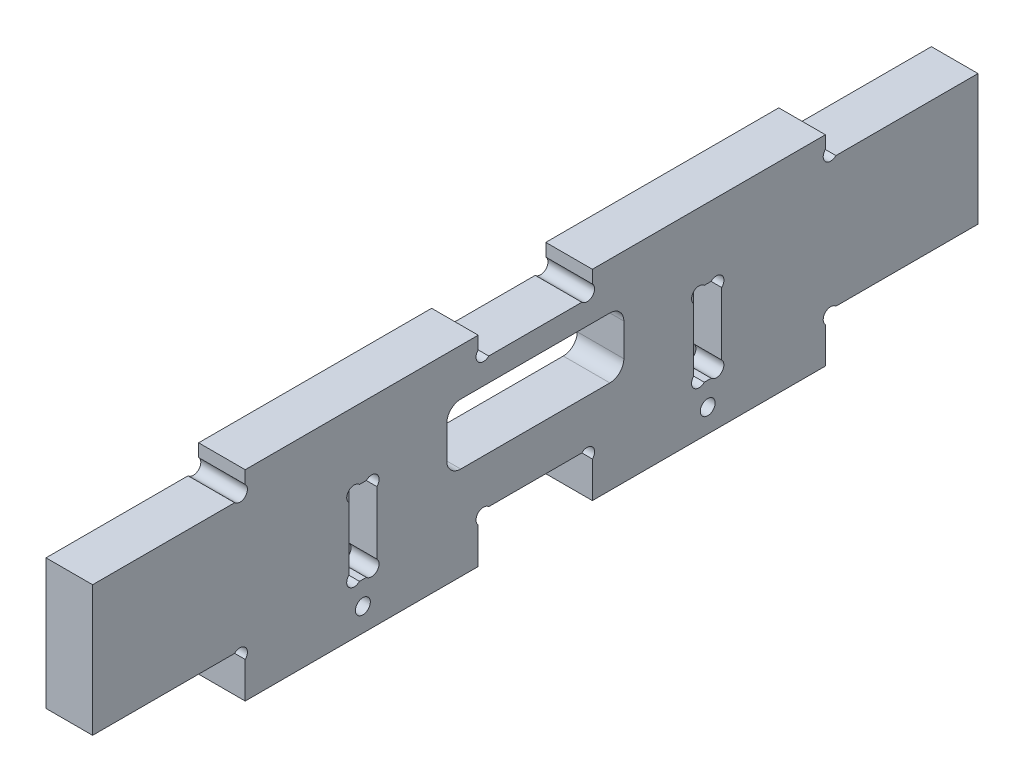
SolidWorks part; units mm, degrees
ref_plane "Plan de face" through (0, 0, 0) normal (0, 0, 1) x (1, 0, 0)
ref_plane "Plan de dessus" through (0, 0, 0) normal (0, 1, 0) x (1, 0, 0)
ref_plane "Plan de droite" through (0, 0, 0) normal (1, 0, 0) x (0, 0, -1)
sketch "Esquisse1" plane through (0, 0, 0) normal (1, 0, 0) x (0, 0, -1)
  line L0 (-8.7019, 0) -> (273.6235, 0) construction
  line L1 (0, -8.4667) -> (0, 81.5583) construction
  line L2 (-8.7019, 43) -> (273.6235, 43) construction
  line L3 (190, 81.5583) -> (190, -8.4667) construction
  line L4 (95, 69.136) -> (95, -8.4667) construction
  line L5 (224.7445, 10) -> (-2.0058, 10) construction
  line L6 (224.7445, 38) -> (-2.0058, 38) construction
  line L7 (57.75, -8.4667) -> (57.75, 58.5112) construction
  line L8 (82.75, 38) -> (99.7783, 55.0283) construction
  line L9 (82.75, -8.4667) -> (82.75, 58.5112) construction
  line L10 (82.75, 7.7373) -> (82.75, 0)
  line L11 (82.75, 10) -> (100.3534, -7.6034) construction
  line L12 (82.75, 40.2627) -> (82.75, 43)
  line L13 (53.3195, 5) -> (203.5554, 5) construction
  line L14 (32.75, 7.7373) -> (32.75, 0)
  line L15 (32.75, 40.2627) -> (32.75, 43)
  line L16 (32.75, 43) -> (82.75, 43)
  line L17 (32.75, 0) -> (82.75, 0)
  line L18 (107.25, 40.2627) -> (107.25, 43)
  line L19 (157.25, 43) -> (107.25, 43)
  line L20 (30.4873, 38) -> (0, 38)
  line L21 (0, 38) -> (0, 10)
  line L22 (0, 10) -> (30.4873, 10)
  line L23 (157.25, 40.2627) -> (157.25, 43)
  line L24 (107.25, 7.7373) -> (107.25, 0)
  line L25 (157.25, 0) -> (107.25, 0)
  line L26 (159.5127, 10) -> (190, 10)
  line L27 (190, 10) -> (190, 38)
  line L28 (190, 38) -> (159.5127, 38)
  line L29 (157.25, 7.7373) -> (157.25, 0)
  line L30 (85.0127, 38) -> (104.9873, 38)
  line L31 (85.0127, 10) -> (104.9873, 10)
  line L32 (135, -8.4667) -> (135, 69.136) construction
  line L33 (129, -8.4667) -> (129, 69.136) construction
  line L35 (132, 40.9973) -> (132, -19.1481) construction
  line L45 (71.6314, 33) -> (120.5346, 33) construction
  line L46 (71.6314, 20) -> (120.5346, 20) construction
  line L47 (114, 30) -> (114, 23)
  line L48 (114, 35.1724) -> (114, 12.2627) construction
  line L49 (76, 30) -> (76, 23)
  line L50 (79, 33) -> (111, 33)
  line L51 (119.5, 35.5) -> (148.8162, 35.5) construction
  line L52 (111, 20) -> (79, 20)
  arc A0 (82.75, 40.2627) -> (85.0127, 38) centre (83.8814, 39.1314) ccw
  arc A1 (85.0127, 10) -> (82.75, 7.7373) centre (83.8814, 8.8686) ccw
  circle A2 centre (58, 5) radius 1.6
  arc A3 (30.4873, 10) -> (32.75, 7.7373) centre (31.6186, 8.8686) cw
  arc A4 (32.75, 40.2627) -> (30.4873, 38) centre (31.6186, 39.1314) cw
  arc A5 (107.25, 40.2627) -> (104.9873, 38) centre (106.1186, 39.1314) cw
  arc A6 (157.25, 40.2627) -> (159.5127, 38) centre (158.3814, 39.1314) ccw
  circle A7 centre (132, 5) radius 1.6
  arc A8 (104.9873, 10) -> (107.25, 7.7373) centre (106.1186, 8.8686) cw
  arc A9 (159.5127, 10) -> (157.25, 7.7373) centre (158.3814, 8.8686) ccw
  arc A18 (76, 30) -> (79, 33) centre (79, 30) cw
  arc A19 (76, 23) -> (79, 20) centre (79, 23) ccw
  arc A20 (114, 23) -> (111, 20) centre (111, 23) cw
  arc A21 (114, 30) -> (111, 33) centre (111, 30) ccw
  point P110 (76, 33)
  point P113 (76, 20)
  point P116 (114, 20)
  point P119 (114, 33)
  dimension "D10" = 5
  dimension "D11" = 55
  dimension "D16" = 3
  dimension "D1" = 190
  dimension "D2" = 43
  dimension "D3" = 95
  dimension "D4" = 5
  dimension "D5" = 10
  dimension "D6" = 45
  dimension "D7" = 25
  dimension "D8" = 45
  dimension "D12" = 6
  dimension "D14" = 3
  dimension "D17" = 7.5
extrude "Extrusion1" add sketch "Esquisse1" along normal blind 10
sketch "Esquisse2" plane through (10, 0, 0) normal (1, 0, 0) x (0, 0, -1)
  line L0 (114, 13.8715) -> (114, 54.1975) construction
  line L1 (129, 54.1975) -> (129, -3.4656) construction
  line L2 (85.7447, 10) -> (145.2408, 10) construction
  line L3 (135, 54.1975) -> (135, -3.4656) construction
  line L4 (132, -2.931) -> (132, 23.1129) construction
  line L5 (117.5167, 28) -> (145.2408, 28) construction
  line L6 (157.25, 43) -> (107.25, 43) construction
  line L7 (95, 47.7056) -> (95, 7.3032) construction
  line L8 (125.1542, 19) -> (140.3528, 19) construction
  line L9 (135, 10) -> (123.6181, 21.3819) construction
  line L10 (131.2627, 28) -> (132.7373, 28)
  line L11 (135, 25.7373) -> (135, 12.2627)
  line L12 (132.7373, 10) -> (131.2627, 10)
  line L13 (129, 12.2627) -> (129, 25.7373)
  line L14 (58.7373, 28) -> (57.2627, 28)
  line L15 (61, 12.2627) -> (61, 25.7373)
  line L16 (55, 25.7373) -> (55, 12.2627)
  line L17 (57.2627, 10) -> (58.7373, 10)
  arc A0 (132.7373, 10) -> (135, 12.2627) centre (133.8686, 11.1314) ccw
  arc A1 (131.2627, 10) -> (129, 12.2627) centre (130.1314, 11.1314) cw
  arc A2 (131.2627, 28) -> (129, 25.7373) centre (130.1314, 26.8686) ccw
  arc A3 (132.7373, 28) -> (135, 25.7373) centre (133.8686, 26.8686) cw
  arc A4 (57.2627, 28) -> (55, 25.7373) centre (56.1314, 26.8686) ccw
  arc A5 (58.7373, 28) -> (61, 25.7373) centre (59.8686, 26.8686) cw
  arc A6 (58.7373, 10) -> (61, 12.2627) centre (59.8686, 11.1314) ccw
  arc A7 (57.2627, 10) -> (55, 12.2627) centre (56.1314, 11.1314) cw
  dimension "D1" = 15
  dimension "D2" = 15
  dimension "D3" = 6
  dimension "D4" = 3
  dimension "D5" = 9
  dimension "D6" = 18
  dimension "D7" = 45
extrude "Enlèv. mat.-Extru.1" cut sketch "Esquisse2" against normal blind 6
